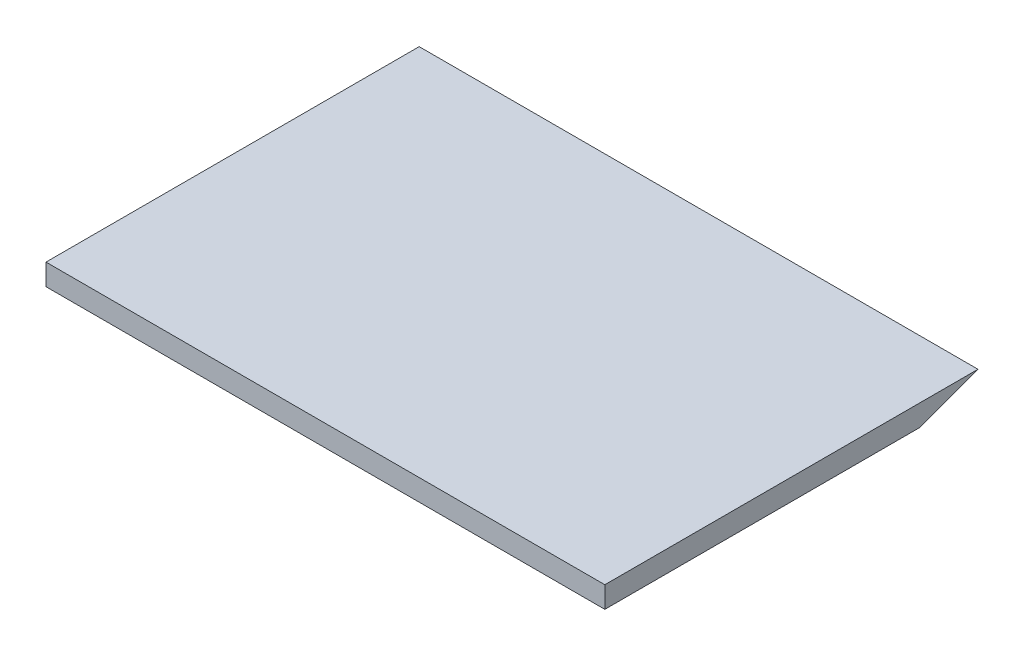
SolidWorks part; units mm, degrees
ref_plane "Front Plane" through (0, 0, 0) normal (0, 0, 1) x (1, 0, 0)
ref_plane "Top Plane" through (0, 0, 0) normal (0, 1, 0) x (1, 0, 0)
ref_plane "Right Plane" through (0, 0, 0) normal (1, 0, 0) x (0, 0, -1)
sketch "Sketch1" plane through (0, 0, 0) normal (0, 0, 1) x (1, 0, 0)
  line L1 (-228.6, -8.7312) -> (228.6, -8.7312)
  line L2 (-228.6, -8.7312) -> (-228.6, 8.7312)
  line L3 (-228.6, 8.7312) -> (228.6, 8.7312)
  line L4 (228.6, -8.7312) -> (228.6, 8.7312)
  line L5 (-228.6, -8.7312) -> (228.6, 8.7312) construction
  line L6 (-228.6, 8.7312) -> (228.6, -8.7312) construction
  point P0 (0, 0)
  dimension "D1" = 17.4625
  dimension "D2" = 457.2
extrude "Boss-Extrude1" add sketch "Sketch1" against normal blind 305.308 contours L3 L4 L1 L2
sketch "Sketch3" plane through (228.6, 0, 0) normal (1, 0, 0) x (0, 0, -1)
  line L0 (305.308, 8.7312) -> (0, 8.7312) construction
  line L2 (305.308, -8.7312) -> (0, -8.7312) construction
  line L4 (305.308, 8.7312) -> (257.7823, -8.7312)
  line L5 (257.7823, -8.7312) -> (305.308, -8.7312)
  line L6 (305.308, -8.7312) -> (305.308, 8.7312)
  dimension "D1" = 20.175
extrude "Cut-Extrude1" cut sketch "Sketch3" against normal through all
